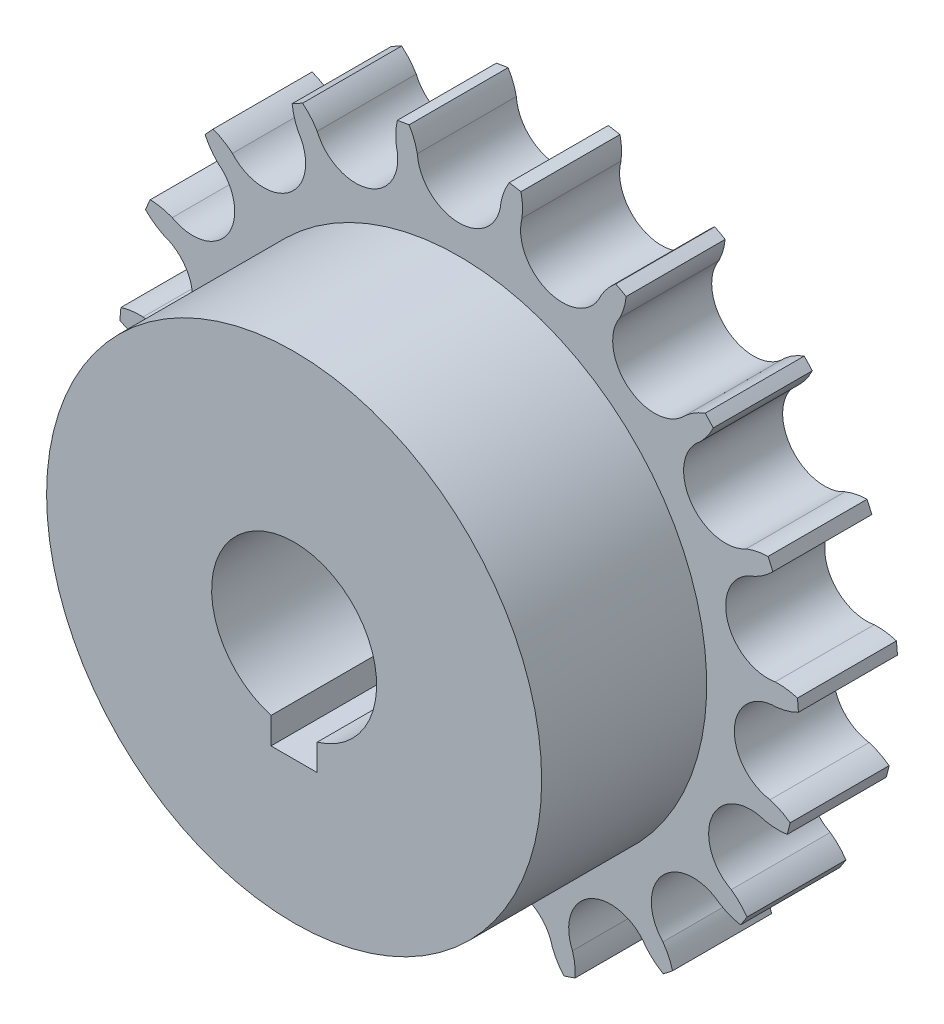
SolidWorks part; units mm, degrees
ref_plane "Face" through (0, 0, 0) normal (0, 0, 1) x (1, 0, 0)
ref_plane "Dessus" through (0, 0, 0) normal (0, 1, 0) x (1, 0, 0)
ref_plane "Droite" through (0, 0, 0) normal (1, 0, 0) x (0, 0, -1)
sketch "Esquisse1" plane through (0, 0, 0) normal (0, 0, 1) x (1, 0, 0)
  arc A0 (9.5213, 47.2484) -> (21.5069, 43.1338) centre (15.6505, 45.5884) ccw
  arc A2 (-6.3361, 47.78) -> (6.3361, 47.78) centre (0, 48.2) ccw
  arc A3 (25.3, 44.8571) -> (23.715, 45.7148) centre (0, 0) ccw
  arc A4 (6.3361, 47.78) -> (7.5865, 50.9381) centre (15.718, 45.892) cw
  arc A5 (-6.3361, 47.78) -> (-7.5865, 50.9381) centre (-15.718, 45.892) ccw
  arc A6 (9.5213, 47.2484) -> (9.3641, 50.6415) centre (0.0347, 48.5091) ccw
  arc A7 (21.5069, 43.1338) -> (23.715, 45.7148) centre (29.7675, 38.3018) cw
  arc A8 (24.347, 41.5968) -> (34.3471, 33.8134) centre (29.6051, 38.0366) ccw
  arc A9 (24.347, 41.5968) -> (25.3, 44.8571) centre (15.7837, 45.8694) ccw
  arc A10 (34.3471, 33.8134) -> (37.2737, 35.5376) centre (40.5912, 26.561) cw
  arc A11 (36.5343, 31.4375) -> (43.4653, 20.8288) centre (40.3514, 26.3629) ccw
  arc A12 (36.5343, 31.4375) -> (38.4943, 34.2117) centre (29.8223, 38.2591) ccw
  arc A13 (43.4653, 20.8288) -> (46.7931, 21.5094) centre (47.0162, 11.942) cw
  arc A14 (44.7625, 17.8715) -> (47.8733, 5.5871) centre (46.7251, 11.8324) ccw
  arc A15 (44.7625, 17.8715) -> (47.5171, 19.8589) centre (40.6292, 26.5029) ccw
  arc A16 (47.8733, 5.5871) -> (51.2418, 5.1502) centre (48.3463, -3.9712) cw
  arc A17 (48.14, 2.3688) -> (47.0936, -10.2601) centre (48.0354, -3.9803) ccw
  arc A18 (48.14, 2.3688) -> (51.3907, 3.3542) centre (47.0332, 11.8746) ccw
  arc A19 (47.0936, -10.2601) -> (50.1377, -11.767) centre (44.4373, -19.4541) cw
  arc A20 (46.3008, -13.3906) -> (41.2104, -24.9954) centre (44.1403, -19.3617) ccw
  arc A21 (46.3008, -13.3906) -> (49.6953, -13.5141) centre (48.3405, -4.0405) ccw
  arc A22 (41.2104, -24.9954) -> (43.6003, -27.4091) centre (35.7128, -32.8287) cw
  arc A23 (39.4442, -27.6989) -> (30.8616, -37.0221) centre (35.4619, -32.645) ccw
  arc A24 (39.4442, -27.6989) -> (42.6146, -28.9179) centre (44.4094, -19.5177) ccw
  arc A25 (30.8616, -37.0221) -> (32.3382, -40.081) centre (23.1183, -42.6459) cw
  arc A26 (28.3132, -39.0056) -> (17.1683, -45.0369) centre (22.9407, -42.3906) ccw
  arc A27 (28.3132, -39.0056) -> (30.916, -41.188) centre (35.6658, -32.8799) ccw
  arc A28 (17.1683, -45.0369) -> (17.5717, -48.4095) centre (8.0186, -47.8418) cw
  arc A29 (14.114, -46.0854) -> (1.6146, -48.1712) centre (7.9335, -47.5426) ccw
  arc A30 (14.114, -46.0854) -> (15.8672, -48.9947) centre (23.0572, -42.679) ccw
  arc A31 (1.6146, -48.1712) -> (0.9011, -51.4921) centre (-7.9501, -47.8532) cw
  arc A32 (-1.6146, -48.1712) -> (-14.114, -46.0854) centre (-7.9335, -47.5426) ccw
  arc A33 (-1.6146, -48.1712) -> (-0.9011, -51.4921) centre (7.9501, -47.8532) ccw
  arc A34 (-14.114, -46.0854) -> (-15.8672, -48.9947) centre (-23.0572, -42.679) cw
  arc A35 (-17.1683, -45.0369) -> (-28.3132, -39.0056) centre (-22.9407, -42.3906) ccw
  arc A36 (-17.1683, -45.0369) -> (-17.5717, -48.4095) centre (-8.0186, -47.8418) ccw
  arc A37 (-28.3132, -39.0056) -> (-30.916, -41.188) centre (-35.6658, -32.8799) cw
  arc A38 (-30.8616, -37.0221) -> (-39.4442, -27.6989) centre (-35.4619, -32.645) ccw
  arc A39 (-30.8616, -37.0221) -> (-32.3382, -40.081) centre (-23.1183, -42.6459) ccw
  arc A40 (-39.4442, -27.6989) -> (-42.6146, -28.9179) centre (-44.4094, -19.5177) cw
  arc A41 (-41.2104, -24.9954) -> (-46.3008, -13.3906) centre (-44.1403, -19.3617) ccw
  arc A42 (-41.2104, -24.9954) -> (-43.6003, -27.4091) centre (-35.7128, -32.8287) ccw
  arc A43 (-46.3008, -13.3906) -> (-49.6953, -13.5141) centre (-48.3405, -4.0405) cw
  arc A44 (-47.0936, -10.2601) -> (-48.14, 2.3688) centre (-48.0354, -3.9803) ccw
  arc A45 (-47.0936, -10.2601) -> (-50.1377, -11.767) centre (-44.4373, -19.4541) ccw
  arc A46 (-48.14, 2.3688) -> (-51.3907, 3.3542) centre (-47.0332, 11.8746) cw
  arc A47 (-47.8733, 5.5871) -> (-44.7625, 17.8715) centre (-46.7251, 11.8324) ccw
  arc A48 (-47.8733, 5.5871) -> (-51.2418, 5.1502) centre (-48.3463, -3.9712) ccw
  arc A49 (-44.7625, 17.8715) -> (-47.5171, 19.8589) centre (-40.6292, 26.5029) cw
  arc A50 (-43.4653, 20.8288) -> (-36.5343, 31.4375) centre (-40.3514, 26.3629) ccw
  arc A51 (-43.4653, 20.8288) -> (-46.7931, 21.5094) centre (-47.0162, 11.942) ccw
  arc A52 (-36.5343, 31.4375) -> (-38.4943, 34.2117) centre (-29.8223, 38.2591) cw
  arc A53 (-34.3471, 33.8134) -> (-24.347, 41.5968) centre (-29.6051, 38.0366) ccw
  arc A54 (-34.3471, 33.8134) -> (-37.2737, 35.5376) centre (-40.5912, 26.561) ccw
  arc A55 (-24.347, 41.5968) -> (-25.3, 44.8571) centre (-15.7837, 45.8694) cw
  arc A56 (-21.5069, 43.1338) -> (-9.5213, 47.2484) centre (-15.6505, 45.5884) ccw
  arc A57 (-21.5069, 43.1338) -> (-23.715, 45.7148) centre (-29.7675, 38.3018) ccw
  arc A58 (-9.5213, 47.2484) -> (-9.3641, 50.6415) centre (-0.0347, 48.5091) cw
  arc A59 (9.3641, 50.6415) -> (7.5865, 50.9381) centre (0, 0) ccw
  arc A60 (-7.5865, 50.9381) -> (-9.3641, 50.6415) centre (0, 0) ccw
  arc A61 (-23.715, 45.7148) -> (-25.3, 44.8571) centre (0, 0) ccw
  arc A62 (-37.2737, 35.5376) -> (-38.4943, 34.2117) centre (0, 0) ccw
  arc A63 (-46.7931, 21.5094) -> (-47.5171, 19.8589) centre (0, 0) ccw
  arc A64 (38.4943, 34.2117) -> (37.2737, 35.5376) centre (0, 0) ccw
  arc A65 (47.5171, 19.8589) -> (46.7931, 21.5094) centre (0, 0) ccw
  arc A66 (51.3907, 3.3542) -> (51.2418, 5.1502) centre (0, 0) ccw
  arc A67 (-51.2418, 5.1502) -> (-51.3907, 3.3542) centre (0, 0) ccw
  arc A68 (-43.6003, -27.4091) -> (-42.6146, -28.9179) centre (0, 0) ccw
  arc A69 (-50.1377, -11.767) -> (-49.6953, -13.5141) centre (0, 0) ccw
  arc A70 (-32.3382, -40.081) -> (-30.916, -41.188) centre (0, 0) ccw
  arc A71 (49.6953, -13.5141) -> (50.1377, -11.767) centre (0, 0) ccw
  arc A72 (42.6146, -28.9179) -> (43.6003, -27.4091) centre (0, 0) ccw
  arc A73 (30.916, -41.188) -> (32.3382, -40.081) centre (0, 0) ccw
  arc A74 (15.8672, -48.9947) -> (17.5717, -48.4095) centre (0, 0) ccw
  arc A75 (-0.9011, -51.4921) -> (0.9011, -51.4921) centre (0, 0) ccw
  arc A76 (-17.5717, -48.4095) -> (-15.8672, -48.9947) centre (0, 0) ccw
  dimension "D2" = 103
  dimension "D3" = 48.2
  dimension "D4" = 12.7
  dimension "D5" = 9.57
extrude "Base-Extrusion" add sketch "Esquisse1" along normal blind 15
sketch "Esquisse3" plane through (0, 0, 15) normal (0, 0, 1) x (1, 0, 0)
  circle A0 centre (0, 0) radius 37.5
  dimension "D1" = 75
extrude "Boss.-Extru.1" add sketch "Esquisse3" along normal blind 25
sketch "Esquisse6" plane through (0, 0, 40) normal (0, 0, 1) x (1, 0, 0)
  circle A0 centre (0, 0) radius 12.5
  dimension "D1" = 25
extrude "Enlèv. mat.-Extru.3" cut sketch "Esquisse6" against normal through all
sketch "Esquisse7" plane through (0, 0, 0) normal (0, 0, -1) x (-1, 0, 0)
  circle A0 centre (0, 0) radius 25
  dimension "D1" = 50
extrude "Enlèv. mat.-Extru.4" cut sketch "Esquisse7" against normal blind 5
sketch "Esquisse8" plane through (0, 0, 0) normal (0, 1, 0) x (1, 0, 0)
  line L0 (-12.5, -40) -> (12.5, -40) construction
  line L1 (-3.5, 0) -> (3.5, 0)
  line L2 (-3.5, 0) -> (-3.5, -40)
  line L3 (-3.5, -40) -> (3.5, -40)
  line L4 (3.5, 0) -> (3.5, -40)
  dimension "D1" = 7
  dimension "D2" = 3.5
extrude "Enlèv. mat.-Extru.5" cut sketch "Esquisse8" against normal blind 16
